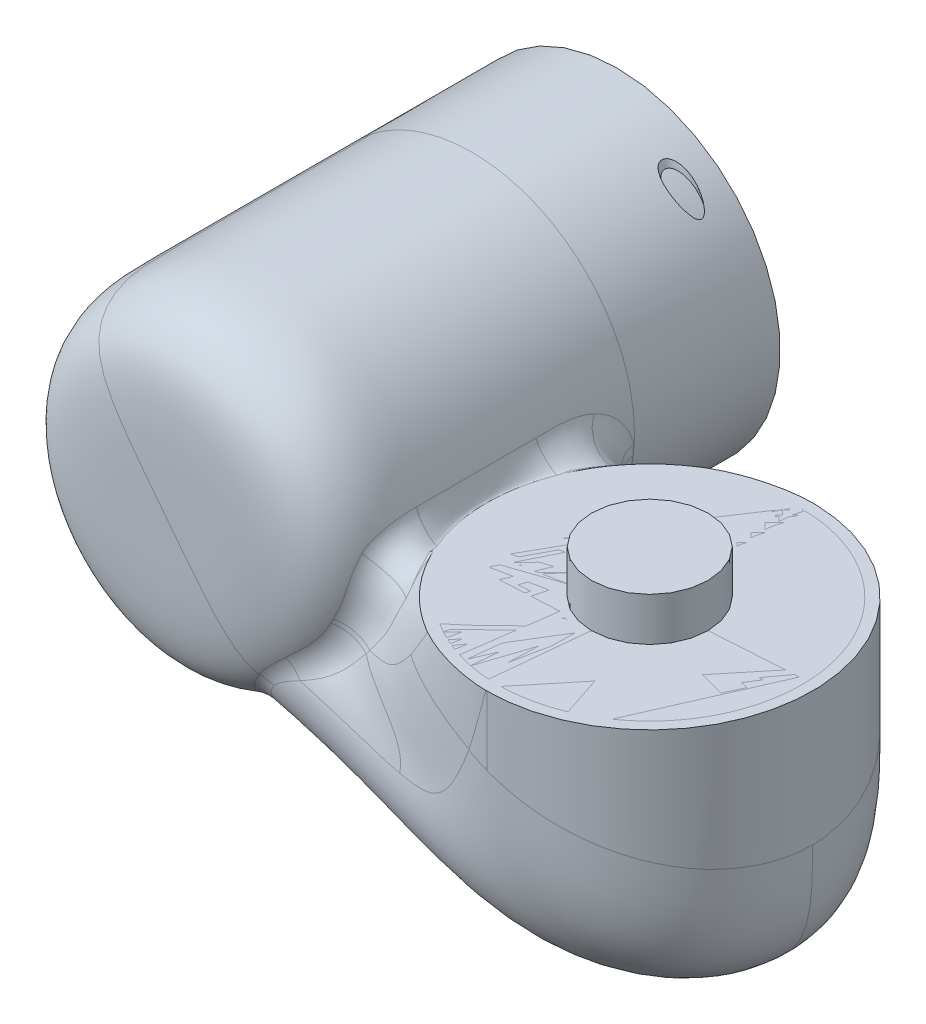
SolidWorks part; units mm, degrees
ref_plane "前视基准面" through (0, 0, 0) normal (0, 0, 1) x (1, 0, 0)
ref_plane "上视基准面" through (0, 0, 0) normal (0, 1, 0) x (1, 0, 0)
ref_plane "右视基准面" through (0, 0, 0) normal (1, 0, 0) x (0, 0, -1)
imported_body "曲面-输入1"
imported_body "曲面-输入2"
imported_body "输入1"
sketch "草图1" plane through (0, 13.0067, 0) normal (0, 1, 0) x (1, 0, 0)
  circle A0 centre (33.1761, -2.5137) radius 37.5
  circle A1 centre (33.1761, -2.5137) radius 13.4312
extrude "凸台-拉伸1" add sketch "草图1" along normal blind 10 contours A1
